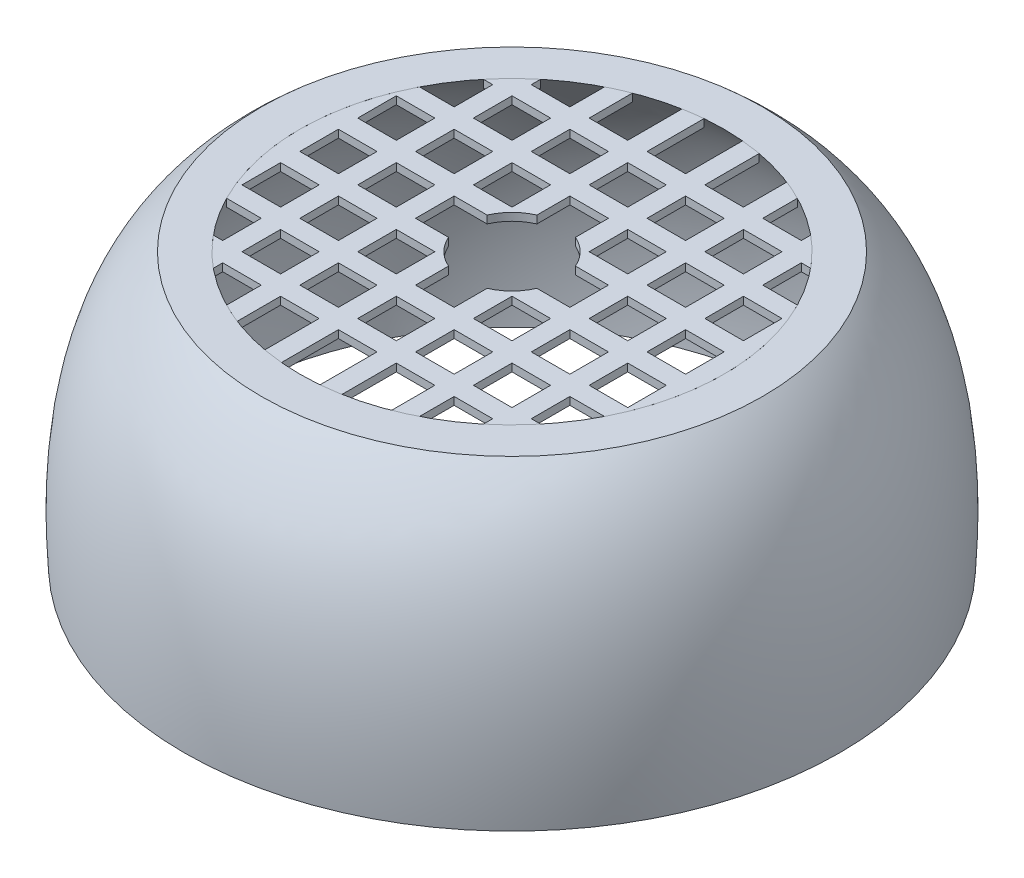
SolidWorks part; units mm, degrees
ref_plane "Alzado" through (0, 0, 0) normal (0, 0, 1) x (1, 0, 0)
ref_plane "Planta" through (0, 0, 0) normal (0, 1, 0) x (1, 0, 0)
ref_plane "Vista lateral" through (0, 0, 0) normal (1, 0, 0) x (0, 0, -1)
sketch "Croquis2" plane through (0, 0, 0) normal (0, 0, 1) x (1, 0, 0)
  line L0 (-65, 70) -> (-55, 70)
  line L1 (-85, 0) -> (-75, 0)
  line L2 (0, 0) -> (0, 101.7099) construction
  spline S0 degree 2 poles (-85, 0) (-88.3713, 49.7982) (-65, 70) knots 0 0 0 0.517639 0.517639 0.517639
  spline S1 degree 2 poles (-75, 0) (-77.8261, 46.4518) (-55, 70) knots 0 0 0 0.542382 0.542382 0.542382
revolve "Revolución1" add sketch "Croquis2" angle 360 about L2
sketch "Croquis3" plane through (0, 70, 0) normal (0, 1, 0) x (1, 0, 0)
  circle A0 centre (0, 0) radius 55
extrude "Saliente-Extruir1" add sketch "Croquis3" against normal blind 2 separate body
sketch "Croquis4" plane through (0, 70, 0) normal (0, 1, 0) x (1, 0, 0)
  circle A0 centre (0, 0) radius 12.5
  dimension "D1" = 25
extrude "Cortar-Extruir1" cut sketch "Croquis4" against normal up to next (2 mm away)
sketch "Croquis5" plane through (0, 70, 0) normal (0, 1, 0) x (1, 0, 0)
  line L0 (-20, -40) -> (-20, -51.2348)
  line L1 (-10, -40) -> (-10, -54.0833)
  line L2 (-40, 35) -> (-40, 25)
  line L3 (-25, 48.9898) -> (-25, 40)
  line L4 (-10, 54.0833) -> (-10, 40)
  line L5 (-25, -40) -> (-35, -40)
  line L6 (-25, -35) -> (-35, -35)
  line L7 (5, 54.7723) -> (5, 40)
  line L8 (20, 51.2348) -> (20, 40)
  line L9 (-10, -40) -> (-20, -40)
  line L10 (-10, -35) -> (-20, -35)
  line L11 (-10, -25) -> (-20, -25)
  line L12 (-10, -25) -> (-10, -35)
  line L13 (-20, -25) -> (-20, -35)
  line L14 (-25, -25) -> (-35, -25)
  line L15 (-25, -20) -> (-35, -20)
  line L16 (50, -10) -> (40, -10)
  line L17 (-35, 42.4264) -> (-35, 40)
  line L18 (50, 5) -> (40, 5)
  line L19 (-20, 51.2348) -> (-20, 40)
  line L20 (50, 20) -> (40, 20)
  line L21 (-5, 55) -> (-5, 40)
  line L22 (-10, -20) -> (-20, -20)
  line L23 (10, 54.0833) -> (10, 40)
  line L24 (-10, -10) -> (-20, -10)
  line L25 (-55, 115) -> (-55, 5)
  line L26 (-55, 130) -> (-55, 20)
  line L27 (-55, 145) -> (-55, 35)
  line L28 (-55, 160) -> (-55, 50)
  line L29 (-55, 100) -> (-55, -10)
  line L30 (-55, 85) -> (-55, -25)
  line L31 (-55, 70) -> (-55, -40)
  line L32 (-25, -10) -> (-35, -10)
  line L33 (-20, -10) -> (-20, -20)
  line L34 (-10, -10) -> (-10, -20)
  line L35 (-25, -5) -> (-35, -5)
  line L36 (50, -20) -> (40, -20)
  line L37 (50, -5) -> (40, -5)
  line L38 (50, 10) -> (40, 10)
  line L39 (-11.3984, -5) -> (-20, -5)
  line L40 (-11.3984, 5) -> (-20, 5)
  line L41 (-25, 5) -> (-35, 5)
  line L42 (-20, 5) -> (-20, -5)
  line L43 (10, -40) -> (10, -54.0833)
  line L44 (-50, 20) -> (-50, 10)
  line L45 (-25, 10) -> (-35, 10)
  line L46 (-10, 10) -> (-20, 10)
  line L47 (-10, 20) -> (-20, 20)
  line L48 (-10, 20) -> (-10, 10)
  line L49 (-20, 20) -> (-20, 10)
  line L50 (-25, 20) -> (-35, 20)
  line L51 (-25, 25) -> (-35, 25)
  line L52 (-10, 25) -> (-20, 25)
  line L53 (-25, 35) -> (-35, 35)
  line L54 (-20, 35) -> (-20, 25)
  line L55 (-10, 35) -> (-10, 25)
  line L56 (20, -25) -> (10, -25)
  line L57 (-10, 35) -> (-20, 35)
  line L58 (35, -40) -> (25, -40)
  line L59 (-10, 40) -> (-20, 40)
  line L60 (42.4264, -35) -> (40, -35)
  line L61 (48.9898, -25) -> (40, -25)
  line L62 (-25, 40) -> (-35, 40)
  line L63 (50, 20) -> (50, 10)
  line L64 (48.9898, 25) -> (40, 25)
  line L65 (42.4264, 35) -> (40, 35)
  line L66 (40, 35) -> (40, 25)
  line L67 (35, 40) -> (25, 40)
  line L68 (35, 42.4264) -> (35, 40)
  line L69 (25, 48.9898) -> (25, 40)
  line L70 (35, -40) -> (35, -42.4264)
  line L71 (-55, 40) -> (-55, -55)
  line L72 (-55, 40) -> (-55, -55)
  line L73 (-55, 40) -> (-55, -55)
  line L74 (55, -55) -> (-55, -55)
  line L75 (-50, 40) -> (-50, 25)
  line L76 (55, 50) -> (25, 50)
  line L77 (35, 55) -> (35, 50)
  line L78 (50, 55) -> (50, 25)
  line L79 (55, -40) -> (40, -40)
  line L80 (55, -25) -> (50, -25)
  line L81 (55, 35) -> (50, 35)
  line L82 (5, -40) -> (-5, -40)
  line L83 (5, -40) -> (5, -54.7723)
  line L84 (-5, -40) -> (-5, -54.7723)
  line L85 (5, -35) -> (-5, -35)
  line L86 (5, -25) -> (-5, -25)
  line L87 (5, -25) -> (5, -35)
  line L88 (-5, -25) -> (-5, -35)
  line L89 (5, -20) -> (-5, -20)
  line L91 (5, -11.3984) -> (5, -20)
  line L92 (-5, -11.3984) -> (-5, -20)
  line L98 (5, 20) -> (-5, 20)
  line L99 (5, 20) -> (5, 11.3984)
  line L100 (-5, 20) -> (-5, 11.3984)
  line L101 (5, 25) -> (-5, 25)
  line L102 (5, 35) -> (-5, 35)
  line L103 (5, 35) -> (5, 25)
  line L104 (-5, 35) -> (-5, 25)
  line L105 (5, 40) -> (-5, 40)
  line L106 (20, -40) -> (20, -51.2348)
  line L107 (25, -40) -> (25, -48.9898)
  line L108 (20, -40) -> (10, -40)
  line L109 (20, -35) -> (10, -35)
  line L110 (20, -25) -> (20, -35)
  line L111 (10, -25) -> (10, -35)
  line L112 (20, -20) -> (10, -20)
  line L113 (20, -10) -> (10, -10)
  line L114 (20, -10) -> (20, -20)
  line L115 (10, -10) -> (10, -20)
  line L116 (20, -5) -> (11.3984, -5)
  line L117 (20, 5) -> (11.3984, 5)
  line L118 (20, 5) -> (20, -5)
  line L120 (20, 20) -> (20, 10)
  line L121 (10, 20) -> (10, 10)
  line L122 (20, 20) -> (10, 20)
  line L123 (20, 10) -> (10, 10)
  line L124 (20, 25) -> (10, 25)
  line L125 (20, 35) -> (10, 35)
  line L126 (20, 40) -> (10, 40)
  line L127 (20, 35) -> (20, 25)
  line L128 (10, 35) -> (10, 25)
  line L129 (35, -35) -> (25, -35)
  line L130 (35, -25) -> (25, -25)
  line L131 (35, -25) -> (35, -35)
  line L132 (25, -25) -> (25, -35)
  line L133 (35, -20) -> (25, -20)
  line L134 (35, -10) -> (25, -10)
  line L135 (35, -10) -> (35, -20)
  line L136 (25, -10) -> (25, -20)
  line L137 (35, -5) -> (25, -5)
  line L138 (35, 5) -> (25, 5)
  line L139 (35, 5) -> (35, -5)
  line L140 (25, 5) -> (25, -5)
  line L141 (35, 10) -> (25, 10)
  line L142 (35, 20) -> (25, 20)
  line L143 (35, 20) -> (35, 10)
  line L144 (25, 20) -> (25, 10)
  line L145 (35, 25) -> (25, 25)
  line L146 (35, 35) -> (25, 35)
  line L147 (35, 35) -> (35, 25)
  line L148 (25, 35) -> (25, 25)
  line L149 (40, -25) -> (40, -35)
  line L150 (40, -10) -> (40, -20)
  line L151 (50, -10) -> (50, -20)
  line L152 (50, 5) -> (50, -5)
  line L153 (40, 5) -> (40, -5)
  line L154 (40, 20) -> (40, 10)
  line L155 (-35, -40) -> (-35, -42.4264)
  line L156 (-25, -40) -> (-25, -48.9898)
  line L157 (-40, -35) -> (-42.4264, -35)
  line L158 (-40, -25) -> (-48.9898, -25)
  line L159 (-40, -20) -> (-50, -20)
  line L160 (-35, -25) -> (-35, -35)
  line L161 (-25, -25) -> (-25, -35)
  line L162 (-40, -10) -> (-50, -10)
  line L163 (-40, -5) -> (-50, -5)
  line L164 (-35, -10) -> (-35, -20)
  line L165 (-25, -10) -> (-25, -20)
  line L166 (-40, 5) -> (-50, 5)
  line L167 (-40, 10) -> (-50, 10)
  line L168 (-40, 20) -> (-50, 20)
  line L169 (-40, 25) -> (-48.9898, 25)
  line L170 (-35, 5) -> (-35, -5)
  line L171 (-25, 5) -> (-25, -5)
  line L172 (-35, 20) -> (-35, 10)
  line L173 (-25, 20) -> (-25, 10)
  line L174 (-40, 35) -> (-42.4264, 35)
  line L175 (-35, 35) -> (-35, 25)
  line L176 (-25, 35) -> (-25, 25)
  line L177 (-40, -25) -> (-40, -35)
  line L178 (-40, -10) -> (-40, -20)
  line L179 (-50, -10) -> (-50, -20)
  line L180 (-40, 20) -> (-40, 10)
  line L181 (-40, 5) -> (-40, -5)
  line L182 (-50, 5) -> (-50, -5)
  arc A0 (-35, -42.4264) -> (-25, -48.9898) centre (0, 0) ccw
  arc A1 (-5, -11.3984) -> (5, -11.3984) centre (0, 0) ccw
  arc A2 (-48.9898, -25) -> (-42.4264, -35) centre (0, 0) ccw
  arc A3 (11.3984, -5) -> (11.3984, 5) centre (0, 0) ccw
  arc A4 (5, 11.3984) -> (-5, 11.3984) centre (0, 0) ccw
  arc A5 (-11.3984, 5) -> (-11.3984, -5) centre (0, 0) ccw
  arc A6 (-42.4264, 35) -> (-48.9898, 25) centre (0, 0) ccw
  arc A8 (-25, 48.9898) -> (-35, 42.4264) centre (0, 0) ccw
  arc A9 (-10, 54.0833) -> (-20, 51.2348) centre (0, 0) ccw
  arc A10 (5, 54.7723) -> (-5, 54.7723) centre (0, 0) ccw
  arc A11 (20, 51.2348) -> (10, 54.0833) centre (0, 0) ccw
  arc A12 (35, 42.4264) -> (25, 48.9898) centre (0, 0) ccw
  arc A14 (48.9898, 25) -> (42.4264, 35) centre (0, 0) ccw
  arc A19 (42.4264, -35) -> (48.9898, -25) centre (0, 0) ccw
  arc A20 (25, -48.9898) -> (35, -42.4264) centre (0, 0) ccw
  arc A21 (10, -54.0833) -> (20, -51.2348) centre (0, 0) ccw
  arc A22 (-5, -54.7723) -> (5, -54.7723) centre (0, 0) ccw
  arc A23 (-20, -51.2348) -> (-10, -54.0833) centre (0, 0) ccw
  dimension "D3" = 2
  dimension "D1" = 8
  dimension "D2" = 8
  dimension "D4" = 2
  dimension "D6" = 2
  dimension "D7" = 2
extrude "Cortar-Extruir2" cut sketch "Croquis5" against normal up to next (2 mm away) contours L176 L53 L175 L51 | L2 L174 L169 M28 | L180 L168 L44 L167 | L173 L50 L172 L45 | L166 L182 L163 L181 | L171 L41 L170 L35 | L162 L179 L159 L178 | L165 L32 L164 L15 | L177 L158 L157 M28 | L161 L14 L160 L6 | L34 L24 L33 L22 | L40 L42 L39 M27 | L47 L49 L46 L48 | L55 L57 L54 L52 | L59 L4 L19 M28 | L62 L3 L17 M28 | L156 L5 L155 M28 | L1 L9 L0 M28 | L11 L13 L10 L12 | L82 L84 L83 M28 | L86 L88 L85 L87 | L92 L89 L91 M27 | L98 L100 L99 M27 | L102 L104 L101 L103 | L105 L7 L21 M28 | L106 L108 L43 M28 | L56 L111 L109 L110 | L113 L115 L112 L114 | L118 L117 L116 M27 | L123 L120 L122 L121 | L125 L128 L124 L127 | L126 L8 L23 M28 | L58 L107 L70 M28 | L130 L132 L129 L131 | L134 L136 L133 L135 | L142 L144 L141 L143 | L146 L148 L145 L147 | L69 L67 L68 M28 | L61 L149 L60 M28 | L151 L16 L150 L36 | L18 L153 L37 L152 | L20 L154 L38 L63 | L65 L66 L64 M28 | L139 L137 L140 L138
